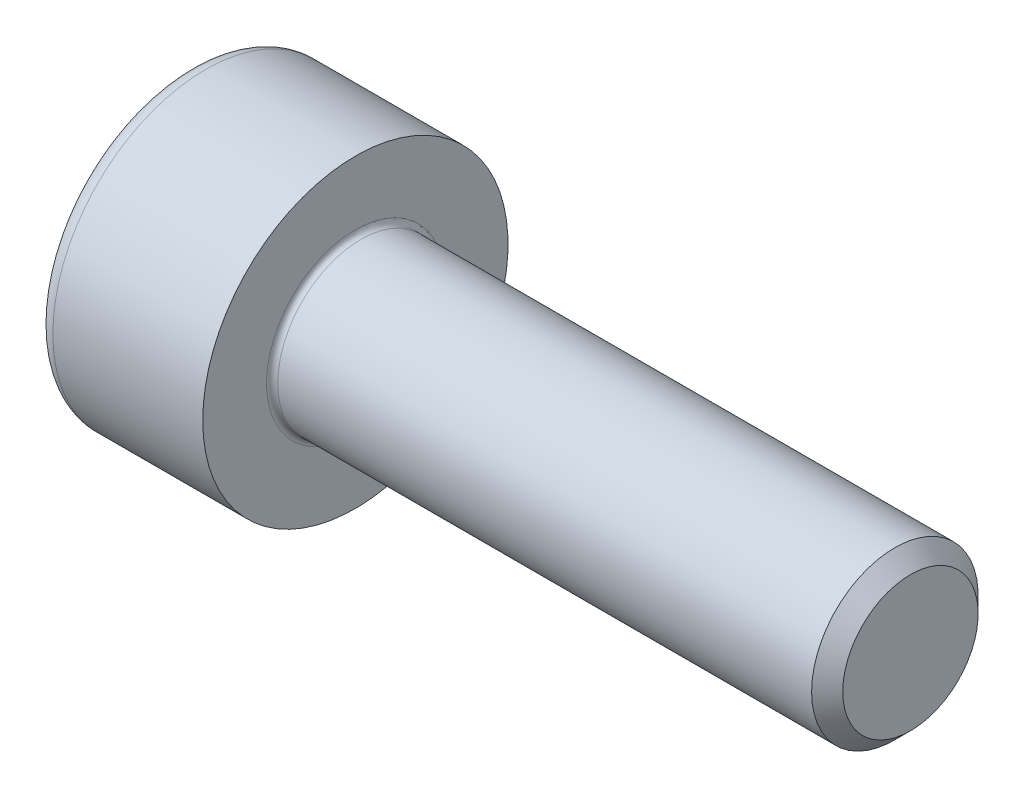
SolidWorks part; units mm, degrees
ref_plane "Plane1" through (0, 0, 0) normal (0, 0, 1) x (1, 0, 0)
ref_plane "Plane2" through (0, 0, 0) normal (0, 1, 0) x (1, 0, 0)
ref_plane "Plane3" through (0, 0, 0) normal (1, 0, 0) x (0, 0, -1)
sketch "BodySke" plane through (0, 0, 0) normal (0, 0, 1) x (1, 0, 0)
  line L0 (0, 0) -> (0, 2.75)
  line L1 (0, 2.75) -> (3, 2.75)
  line L2 (3, 2.75) -> (3, 1.5)
  line L3 (3, 1.5) -> (12.7195, 1.5)
  line L4 (13, 1.2195) -> (13, 0)
  line L5 (13, 0) -> (0, 0)
  line L6 (-31.75, 0) -> (127, 0) construction
  line L8 (13, 1.2195) -> (12.7195, 1.5)
  line L10 (13, -1.2195) -> (12.7195, -1.5) construction
  line L11 (3.5, 9.525) -> (3.5, 3.175) construction
  line L12 (3, 9.525) -> (3, 3.175) construction
  line L13 (-47, 9.525) -> (-47, 3.175) construction
  dimension "Diameter" = 3
  dimension "Head_ht" = 3
  dimension "Length" = 10
  dimension "Body_ch_ang" = 45
  dimension "Head_dia" = 5.5
  dimension "Minor_dia" = 2.439
  dimension "Advance" = 0.5
  dimension "Thread_nom" = 10
  dimension "Thread_length" = 60
revolve "Base-Revolve" add sketch "BodySke"
fillet "Fillet1" radius 0.1 1 edges at (3, 0, 1.5)
fillet "Fillet2" radius 0.3 1 edges at (0, 0, 2.75)
sketch "Sketch2" plane through (0, 0, 0) normal (0, 0, 1) x (1, 0, 0)
  line L0 (0, 1.26) -> (1.3, 1.26)
  line L1 (1.3, 1.26) -> (2.0275, 0)
  line L2 (-31.75, 0) -> (127, 0) construction
  line L3 (2.0275, 0) -> (0, 0)
  line L4 (0, 0) -> (0, 1.26)
  line L6 (0, 0) -> (47.625, 0) construction
  dimension "D1" = 1.26
  dimension "D2" = 60
  dimension "Depth" = 1.3
revolve "Hex-PreBroach" cut sketch "Sketch2" angle 360 about L6
sketch "Sketch3" plane through (0, 0, 0) normal (-1, 0, 0) x (0, 0.5, 0.866)
  line L0 (0.7275, 1.26) -> (-0.7275, 1.26)
  line L1 (-0.7275, 1.26) -> (-1.4549, 0)
  line L2 (0.7275, 1.26) -> (1.4549, 0)
  line L3 (0.7275, -1.26) -> (1.4549, 0)
  line L4 (0.7275, -1.26) -> (-0.7275, -1.26)
  line L5 (-0.7275, -1.26) -> (-1.4549, 0)
  dimension "D1" = 1.26
  dimension "D2" = 1.26
  dimension "Hex_size" = 2.52
extrude "Hex" cut sketch "Sketch3" against normal blind 1.3
sketch "ThdSchSke" plane through (0, 0, 0) normal (0, 0, 1) x (1, 0, 0)
  line L0 (4.5, -1.2195) -> (4.3036, -1.5)
  line L1 (4.5, -1.2195) -> (4.6964, -1.5)
  line L2 (4.6964, -1.5) -> (4.6964, -1.875)
  line L3 (-3.175, 0) -> (5.1513, 0) construction
  line L4 (0, 2.45) -> (0, -2.45) construction
  line L5 (4.6964, -1.875) -> (4.3036, -1.875)
  line L6 (4.3036, -1.875) -> (4.3036, -1.5)
  dimension "Thread_minor" = 2.439
  dimension "Diameter" = 3
  dimension "Start" = 4.5
  dimension "SideAngle" = 55
  dimension "VeeAngle" = 70
  dimension "Overcut" = 3.75
revolve "ThreadSchematic" [suppressed] cut sketch "ThdSchSke" angle 360 about L3
pattern_linear "ThdSchPat" [suppressed]
equation "\"D2@Sketch3\" = \"Hex_size@Sketch3\" / 2"
equation "\"D1@Sketch3\" = \"Hex_size@Sketch3\" / 2"
equation "\"D1@Sketch2\" = \"Hex_size@Sketch3\" / 2"
equation "\"Thread_minor@ThreadCosmetic\"  =  \"Minor_dia@BodySke\""
equation "\"Depth@Sketch2\" =  \"Key_eng@Hex\""
equation "\"Thread_length@ThreadCosmetic\" = ((sgn( (\"Length@BodySke\" - \"Advance@BodySke\" * 3.0) - \"Thread_nom@BodySke\" )-1)*( (\"Length@BodySke\" - \"Advance@BodySke\" * 3.0) - \"Thread_nom@BodySke\" ))/-2+ \"Thread_no"
equation "\"Thread_minor@ThdSchSke\" = \"Minor_dia@BodySke\""
equation "\"Diameter@ThdSchSke\" = \"Diameter@BodySke\""
equation "\"Overcut@ThdSchSke\" = \"Diameter@BodySke\" * 1.25"
equation "\"Start@ThdSchSke\" = \"Head_ht@BodySke\" + \"Length@BodySke\" - \"Thread_length@ThreadCosmetic\"  '---Non-countersunk---"
equation "\"Num_threads@ThdSchPat\" = int( \"Thread_length@ThreadCosmetic\" / \"Advance@BodySke\" + 0.999 )  + 1"
equation "\"Advance@ThdSchPat\" = \"Thread_length@ThreadCosmetic\" /  (\"Num_threads@ThdSchPat\" - 1) 'relax it"
equation "\"Num_threads@ThdSchPat\" = \"Num_threads@ThdSchPat\" - sgn( \"Num_threads@ThdSchPat\" - 1) '---chamfered tips only---"
